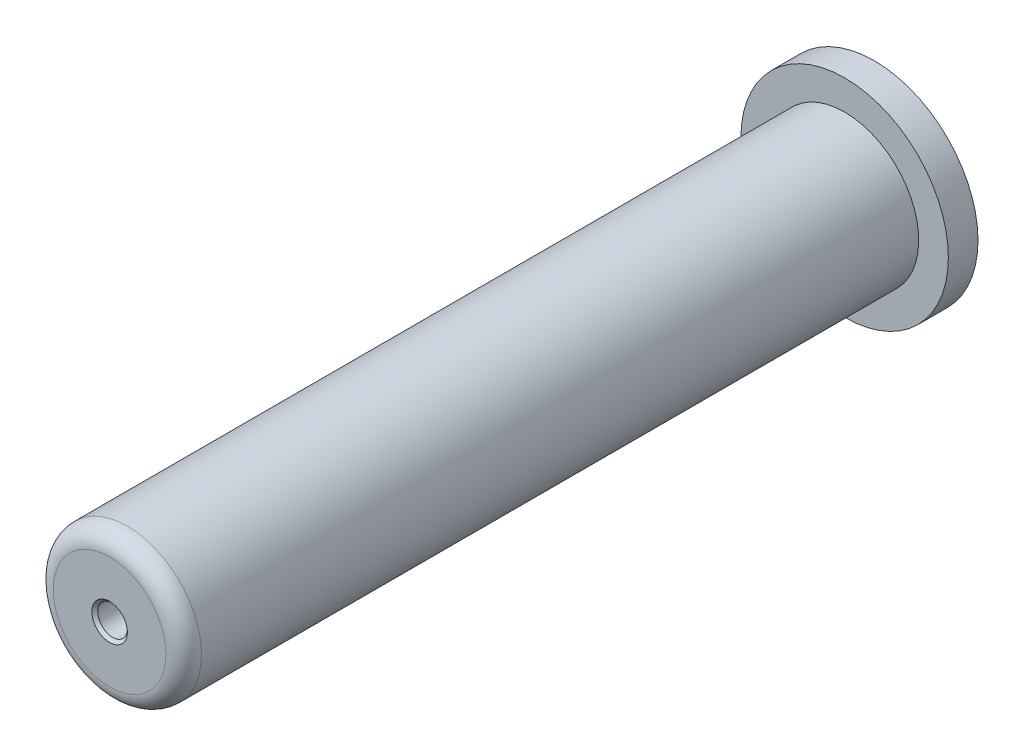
SolidWorks part; units mm, degrees
ref_plane "Front Plane" through (0, 0, 0) normal (0, 0, 1) x (1, 0, 0)
ref_plane "Top Plane" through (0, 0, 0) normal (0, 1, 0) x (1, 0, 0)
ref_plane "Right Plane" through (0, 0, 0) normal (1, 0, 0) x (0, 0, -1)
sketch "Sketch1" plane through (0, 0, 0) normal (1, 0, 0) x (0, 0, -1)
  line L0 (0, 0) -> (-129, 0) construction
  line L1 (0, 0) -> (0, 17.5)
  line L2 (0, 17.5) -> (-5, 17.5)
  line L3 (-5, 17.5) -> (-5, 12.5)
  line L4 (-5, 12.5) -> (-126, 12.5)
  line L5 (-129, 9.5) -> (-129, 3)
  line L6 (-128.5, 2.5) -> (-123, 2.5)
  line L7 (-123, 2.5) -> (-121.2495, 0)
  line L8 (-128.5, 2.5) -> (-129, 3)
  line L9 (0, 0) -> (-121.2495, 0)
  arc A0 (-126, 12.5) -> (-129, 9.5) centre (-126, 9.5) ccw
  dimension "D5" = 3
  dimension "D1" = 5
  dimension "D2" = 124
  dimension "D3" = 17.5
  dimension "D4" = 12.5
  dimension "D6" = 2.5
  dimension "D7" = 0.5
  dimension "D8" = 55
  dimension "D9" = 45
  dimension "D10" = 6
revolve "Revolve1" add sketch "Sketch1" angle 360 about L0
